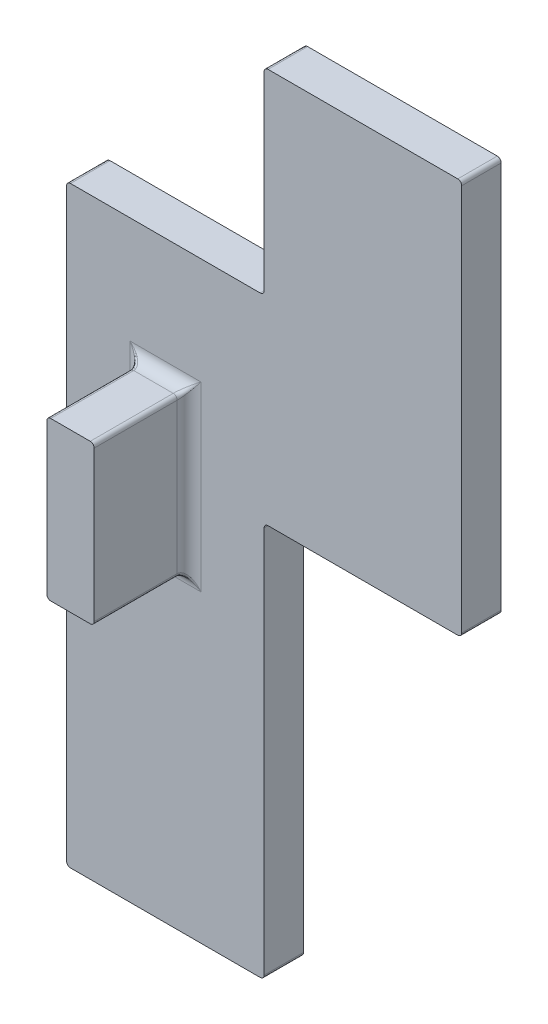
SolidWorks part; units mm, degrees
ref_plane "Ebene vorne" through (0, 0, 0) normal (0, 0, 1) x (1, 0, 0)
ref_plane "Ebene oben" through (0, 0, 0) normal (0, 1, 0) x (1, 0, 0)
ref_plane "Ebene rechts" through (0, 0, 0) normal (1, 0, 0) x (0, 0, -1)
sketch "Skizze1" plane through (0, 0, 0) normal (0, 0, 1) x (1, 0, 0)
  line L0 (0, 0) -> (0, 75)
  line L1 (0, 75) -> (25, 75)
  line L2 (25, 75) -> (25, 100)
  line L3 (25, 100) -> (50, 100)
  line L4 (50, 100) -> (50, 50)
  line L5 (50, 50) -> (25, 50)
  line L6 (25, 50) -> (25, 0)
  line L7 (25, 0) -> (0, 0)
  dimension "D1" = 25
  dimension "D2" = 50
  dimension "D3" = 25
  dimension "D4" = 75
extrude "Aufsatz-Linear austragen1" add sketch "Skizze1" along normal blind 5
sketch "Skizze2" plane through (0, 0, 0) normal (0, 0, -1) x (-1, 0, 0)
  line L0 (-25, 50) -> (-50, 50) construction
  circle A0 centre (-37.5, 62.5) radius 2.7
  point P4 (-37.5, 50)
  dimension "D1" = 5.4
  dimension "D2" = 12.5
extrude "Schnitt-Linear austragen1" cut sketch "Skizze2" against normal blind 2.9 from offset 0.8
fillet "Verrundung1" radius 0.5 8 edges at (25, 100, 2.5) (25, 75, 2.5) (0, 75, 2.5) (50, 100, 2.5) (25, 50, 2.5) (0, 0, 2.5) (25, 0, 2.5) (50, 50, 2.5)
sketch "Skizze3" plane through (0, 0, 5) normal (0, 0, 1) x (1, 0, 0)
  line L0 (24.5, 75) -> (0.5, 75) construction
  line L1 (9.5, 60) -> (15.5, 60)
  line L2 (9.5, 60) -> (9.5, 40)
  line L3 (9.5, 40) -> (15.5, 40)
  line L4 (15.5, 60) -> (15.5, 40)
  line L6 (0.5, 0) -> (24.5, 0) construction
  point P6 (12.5, 75)
  point P7 (12.5, 60)
  point P12 (9.5, 50)
  dimension "D1" = 6
  dimension "D2" = 20
  dimension "D3" = 50
extrude "Aufsatz-Linear austragen2" add sketch "Skizze3" along normal blind 12
fillet "Verrundung2" radius 1.5 4 edges at (12.5, 60, 5) (9.5, 50, 5) (12.5, 40, 5) (15.5, 50, 5)
fillet "Verrundung3" radius 0.5 8 edges at (15.9393, 60.4393, 5.4393) (15.9393, 39.5607, 5.4393) (9.0607, 39.5607, 5.4393) (9.0607, 60.4393, 5.4393) (15.5, 60, 11.75) (15.5, 40, 11.75) (9.5, 40, 11.75) (9.5, 60, 11.75)
